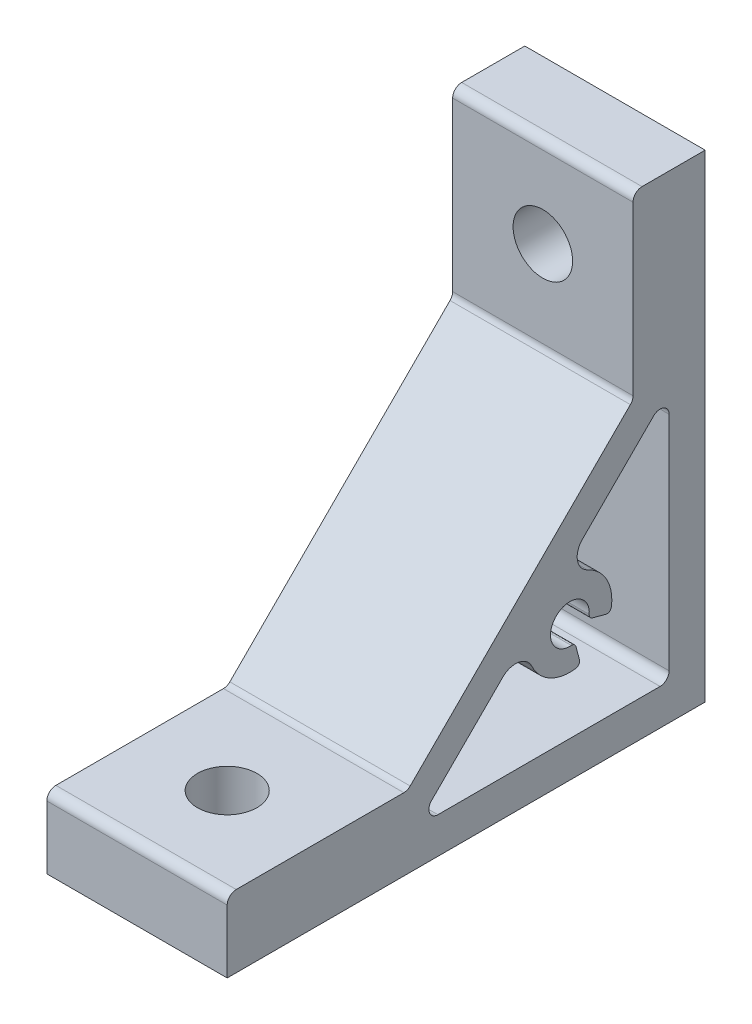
SolidWorks part; units mm, degrees
ref_plane "正面" through (0, 0, 0) normal (0, 0, 1) x (1, 0, 0)
ref_plane "平面" through (0, 0, 0) normal (0, 1, 0) x (1, 0, 0)
ref_plane "右側面" through (0, 0, 0) normal (1, 0, 0) x (0, 0, -1)
sketch "ｽｹｯﾁ1" plane through (0, 0, 0) normal (1, 0, 0) x (0, 0, -1)
  line L13 (0, 0) -> (0, 53)
  line L14 (-8, 33.4142) -> (-8, 52)
  line L15 (-8.2929, 32.7071) -> (-32.7071, 8.2929)
  line L16 (-53, 0) -> (0, 0)
  line L17 (-43, -2.6395) -> (-43, 9.9667) construction
  line L18 (-52, 8) -> (-33.4142, 8)
  line L19 (-53, 0) -> (-53, 7)
  line L20 (-4, 5) -> (-4, 29.636)
  line L21 (-15, 9.5192) -> (-15, 20.4496) construction
  line L22 (-29.636, 4) -> (-5, 4)
  line L23 (-20.453, 15) -> (-9.6217, 15) construction
  line L24 (-22.4428, 13.6074) -> (-30.3431, 5.7071)
  line L25 (-13.9337, 11.0206) -> (-14.3264, 12.4863)
  line L26 (-11.0206, 13.9337) -> (-12.4863, 14.3264)
  line L27 (-11.0542, 43) -> (2.4534, 43) construction
  line L28 (-5.7071, 30.3431) -> (-13.6074, 22.4428)
  line L29 (-7, 53) -> (0, 53)
  arc A16 (-52, 8) -> (-53, 7) centre (-52, 7) ccw
  arc A17 (-33.4142, 8) -> (-32.7071, 8.2929) centre (-33.4142, 9) ccw
  arc A18 (-10.3962, 14.3464) -> (-13.0373, 19.2155) centre (-15, 15) ccw
  arc A19 (-12.8556, 14.8454) -> (-14.8454, 12.8556) centre (-15, 15) ccw
  arc A20 (-19.2155, 13.0373) -> (-22.4428, 13.6074) centre (-21.0286, 12.1932) ccw
  arc A21 (-30.3431, 5.7071) -> (-29.636, 4) centre (-29.636, 5) ccw
  arc A22 (-14.3264, 12.4863) -> (-14.8454, 12.8556) centre (-14.8094, 12.3569) ccw
  arc A23 (-19.2155, 13.0373) -> (-14.3464, 10.3962) centre (-15, 15) ccw
  arc A24 (-14.3464, 10.3962) -> (-13.9337, 11.0206) centre (-14.4167, 10.8912) ccw
  arc A25 (-12.8556, 14.8454) -> (-12.4863, 14.3264) centre (-12.3569, 14.8094) ccw
  arc A26 (-11.0206, 13.9337) -> (-10.3962, 14.3464) centre (-10.8912, 14.4167) ccw
  arc A27 (-5, 4) -> (-4, 5) centre (-5, 5) ccw
  arc A28 (-13.6074, 22.4428) -> (-13.0373, 19.2155) centre (-12.1932, 21.0286) ccw
  arc A29 (-4, 29.636) -> (-5.7071, 30.3431) centre (-5, 29.636) ccw
  arc A30 (-8.2929, 32.7071) -> (-8, 33.4142) centre (-9, 33.4142) ccw
  arc A31 (-7, 53) -> (-8, 52) centre (-7, 52) ccw
extrude "押し出し1" add sketch "ｽｹｯﾁ1" along normal mid plane 20
hole_wizard "Ø6.6 (6.6) 直径の穴1" positions "3Dｽｹｯﾁ1" profile "ｽｹｯﾁ3" hole size "Ø6.6" standard "JIS"
sketch3d "3Dｽｹｯﾁ1"
  line L4 (-10, 8, 33.4142) -> (-10, 8, 52) construction
  line L5 (10, 52, 8) -> (10, 33.4142, 8) construction
  point P16 (0, 43, 8)
  point P18 (0, 8, 43)
  dimension "D1" = 10
  dimension "D2" = 10
  dimension "D3" = 10
  dimension "D4" = 10
sketch "ｽｹｯﾁ3" plane through (0, 43, 8) normal (1, 0, 0) x (0, -1, 0)
  line L0 (0, 0) -> (0, 8)
  line L1 (0, 8) -> (3.3, 8)
  line L2 (3.3, 8) -> (3.3, 0)
  line L5 (3.3, 0) -> (0, 0)
  line L11 (0, -6.35) -> (0, 107.95) construction
  dimension "通し穴の直径" = 6.6
  dimension "通し穴の深さ" = 8
